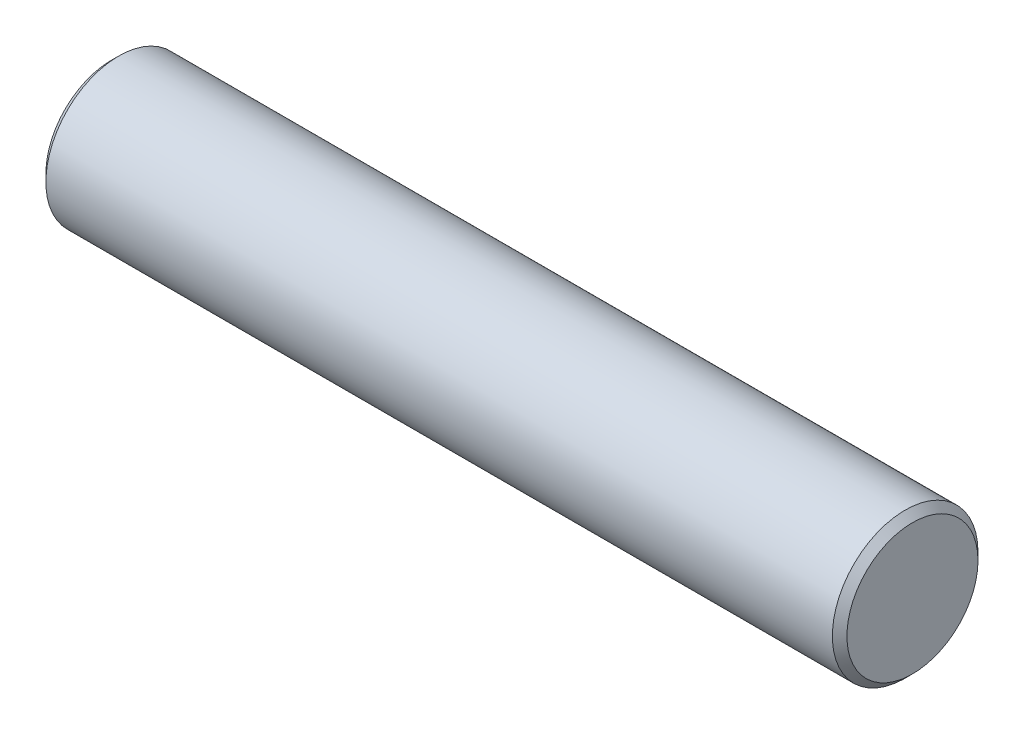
SolidWorks part; units mm, degrees
ref_plane "Спереди" through (0, 0, 0) normal (0, 0, 1) x (1, 0, 0)
ref_plane "Сверху" through (0, 0, 0) normal (0, 1, 0) x (1, 0, 0)
ref_plane "Справа" through (0, 0, 0) normal (1, 0, 0) x (0, 0, -1)
sketch "Эскиз1" plane through (0, 0, 0) normal (1, 0, 0) x (0, 0, -1)
  circle A0 centre (0, 0) radius 5
  dimension "D1" = 10
extrude "Бобышка-Вытянуть1" add sketch "Эскиз1" along normal mid plane 55
chamfer "Фаска1" distance 0.5 angle 45 2 edges at (-27.5, 0, -5) (27.5, 0, -5)
